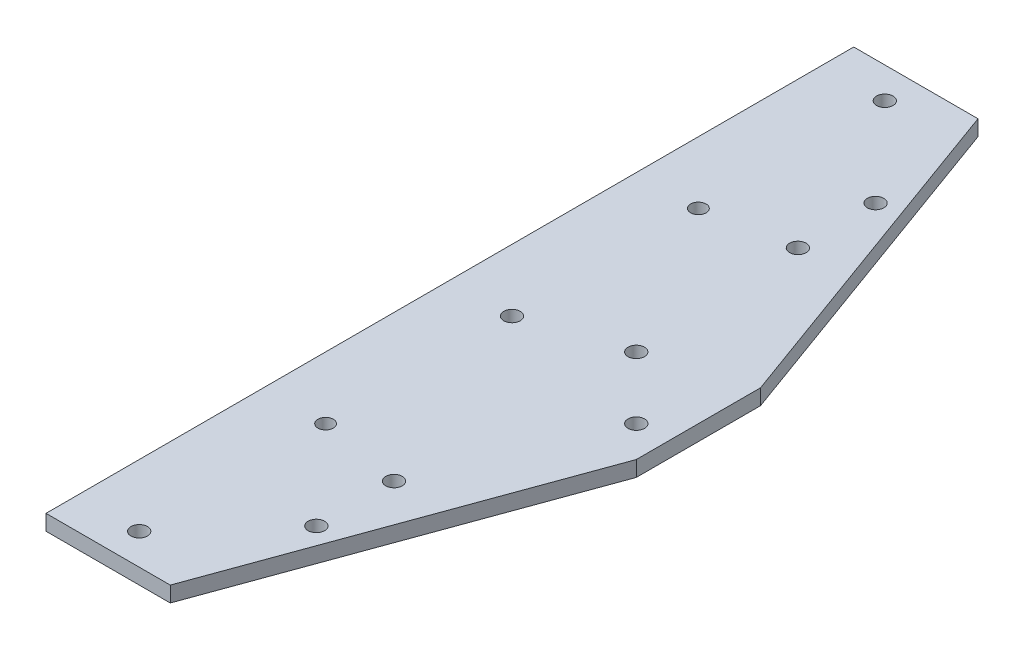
SolidWorks part; units mm, degrees
ref_plane "Front" through (0, 0, 0) normal (0, 0, 1) x (1, 0, 0)
ref_plane "Top" through (0, 0, 0) normal (0, 1, 0) x (1, 0, 0)
ref_plane "Right" through (0, 0, 0) normal (1, 0, 0) x (0, 0, -1)
sketch "Sketch1" plane through (0, 0, 0) normal (0, 1, 0) x (1, 0, 0)
  line L0 (0, 25.4) -> (101.6, 25.4) construction
  line L2 (0, 0) -> (0, 50.8)
  line L3 (101.6, 50.8) -> (50.8, 190.5)
  line L4 (101.6, 0) -> (101.6, 50.8)
  line L5 (38.1, 38.1) -> (118.3211, 38.1) construction
  line L6 (0, -18.4727) -> (0, -139.7)
  line L7 (0, -139.7) -> (50.8, -139.7)
  line L8 (101.6, 0) -> (50.8, -139.7)
  line L9 (0, 50.8) -> (0, 190.5)
  line L10 (0, 190.5) -> (50.8, 190.5)
  line L13 (0, 0) -> (0, -18.4727)
  circle A0 centre (88.9, 12.7011) radius 3.3731
  circle A1 centre (63.5, 38.1011) radius 3.3731
  circle A4 centre (25.4, 177.8) radius 3.3731
  circle A5 centre (25.4, -127) radius 3.3731
  circle A6 centre (25.4, 25.4) radius 3.3731
  dimension "D3" = 50.8
  dimension "D12" = 12.7
  dimension "D2" = 101.6
  dimension "D5" = 165.1
  dimension "D6" = 50.8
extrude "Extrude1" add sketch "Sketch1" along normal blind 6.35
sketch "Sketch3" plane through (0, 6.35, 0) normal (0, 1, 0) x (1, 0, 0)
  line L0 (25.4, 25.4) -> (25.4, 127) construction
  line L1 (25.4, 25.4) -> (114.8548, 25.4) construction
  line L2 (59.7232, 107.95) -> (59.7232, 197.2798) construction
  line L3 (101.6, 25.4) -> (144.4834, 25.4) construction
  line L4 (101.6, 0) -> (101.6, 50.8) construction
  circle A1 centre (25.4, 101.6) radius 3.1544
  circle A2 centre (59.7232, 107.95) radius 3.3731
  circle A3 centre (59.7232, 139.7) radius 3.3731
  circle A4 centre (59.7232, -88.9) radius 3.3731
  circle A5 centre (25.4, -50.8) radius 3.1544
  circle A6 centre (59.7232, -57.15) radius 3.3731
  dimension "D1" = 6.7462
  dimension "D2" = 31.75
  dimension "D3" = 76.2
  dimension "D4" = 82.55
extrude "Extrude3" cut sketch "Sketch3" against normal through all
